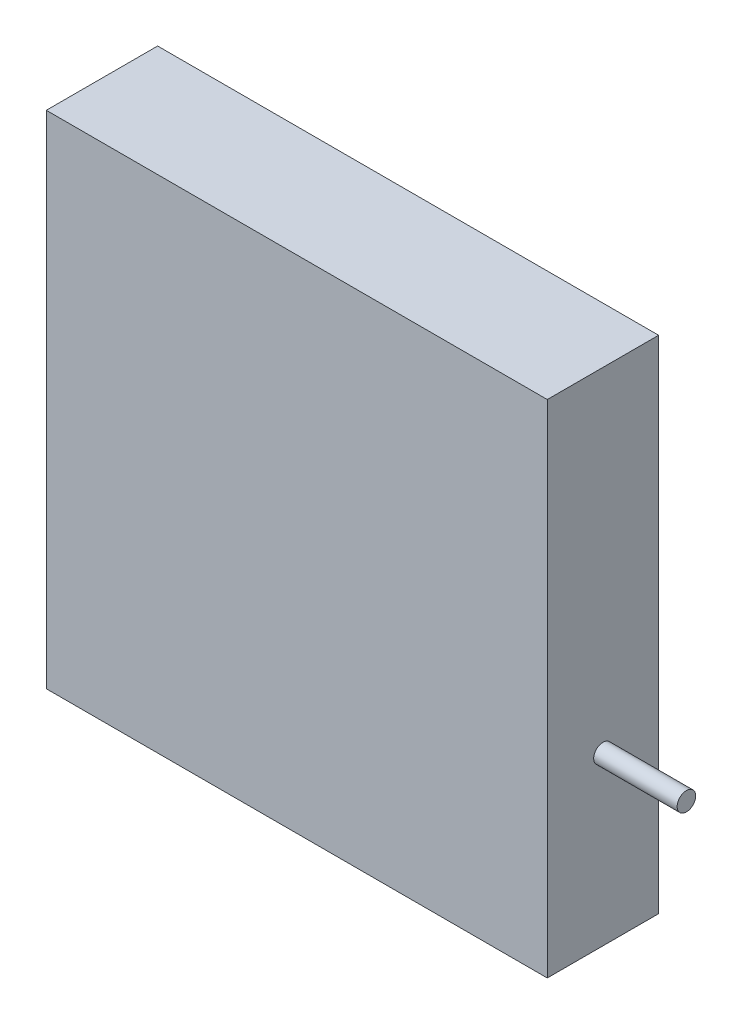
SolidWorks part; units mm, degrees
ref_plane "Front Plane" through (0, 0, 0) normal (0, 0, 1) x (1, 0, 0)
ref_plane "Top Plane" through (0, 0, 0) normal (0, 1, 0) x (1, 0, 0)
ref_plane "Right Plane" through (0, 0, 0) normal (1, 0, 0) x (0, 0, -1)
sketch "Sketch2" plane through (0, 0, 0) normal (0, 0, 1) x (1, 0, 0)
  line L1 (-135, 135) -> (135, 135)
  line L2 (-135, 135) -> (-135, -135)
  line L3 (-135, -135) -> (135, -135)
  line L4 (135, 135) -> (135, -135)
  line L5 (-135, 135) -> (135, -135) construction
  line L6 (-135, -135) -> (135, 135) construction
  point P0 (0, 0)
  dimension "D1" = 270
  dimension "D2" = 270
extrude "Boss-Extrude1" add sketch "Sketch2" along normal mid plane 75
sketch "Sketch3" plane through (0, 0, -37.5) normal (0, 0, -1) x (-1, 0, 0)
  line L1 (-97.5, 100) -> (97.5, 100)
  line L2 (-97.5, 100) -> (-97.5, -100)
  line L3 (-97.5, -100) -> (97.5, -100)
  line L4 (97.5, 100) -> (97.5, -100)
  line L5 (-97.5, 100) -> (97.5, -100) construction
  line L6 (-97.5, -100) -> (97.5, 100) construction
  line L7 (135, 135) -> (135, -135) construction
  line L8 (135, -135) -> (-135, -135) construction
  line L9 (-135, -135) -> (-135, 135) construction
  line L10 (-135, 135) -> (135, 135) construction
  line L11 (135, 135) -> (135, -135)
  line L12 (135, -135) -> (-135, -135)
  line L13 (-135, -135) -> (-135, 135)
  line L14 (-135, 135) -> (135, 135)
  point P0 (0, 0)
  dimension "D1" = 200
  dimension "D2" = 195
extrude "Cut-Extrude1" cut sketch "Sketch3" against normal blind 15
sketch "Sketch4" plane through (0, 0, -22.5) normal (0, 0, -1) x (-1, 0, 0)
  line L0 (97.5, -100) -> (97.5, 100) construction
  line L1 (97.5, 100) -> (-97.5, 100) construction
  line L2 (-97.5, 100) -> (-97.5, -100) construction
  line L3 (-97.5, -100) -> (97.5, -100) construction
  line L4 (-135, -135) -> (135, -135) construction
  line L5 (135, -135) -> (135, 135) construction
  line L6 (-135, 135) -> (-135, -135) construction
  line L7 (135, 135) -> (-135, 135) construction
  line L8 (97.5, -100) -> (97.5, 100)
  line L9 (97.5, 100) -> (-97.5, 100)
  line L10 (-97.5, 100) -> (-97.5, -100)
  line L11 (-97.5, -100) -> (97.5, -100)
  line L12 (-135, -135) -> (135, -135)
  line L13 (135, -135) -> (135, 135)
  line L14 (-135, 135) -> (-135, -135)
  line L15 (135, 135) -> (-135, 135)
  line L16 (125, 125) -> (-125, 125)
  line L17 (-125, 125) -> (-125, -125)
  line L18 (-125, -125) -> (125, -125)
  line L19 (125, -125) -> (125, 125)
  line L20 (-111.5, 114) -> (-111.5, -114)
  line L21 (-111.5, -114) -> (111.5, -114)
  line L22 (111.5, -114) -> (111.5, 114)
  line L23 (111.5, 114) -> (-111.5, 114)
  dimension "D1" = 10
  dimension "D2" = 14
extrude "Cut-Extrude2" cut sketch "Sketch4" against normal blind 8 contours L18 L19 L16 L17 L23 L22 L21 L20
sketch "Sketch5" plane through (135, 0, 0) normal (1, 0, 0) x (0, 0, -1)
  line L0 (22.5, 135) -> (22.5, -135) construction
  line L3 (-37.5, -135) -> (22.5, -135) construction
  circle A0 centre (-7.5, -45) radius 5
  dimension "D3" = 10
  dimension "D1" = 30
  dimension "D2" = 90
extrude "Boss-Extrude2" add sketch "Sketch5" along normal blind 45
